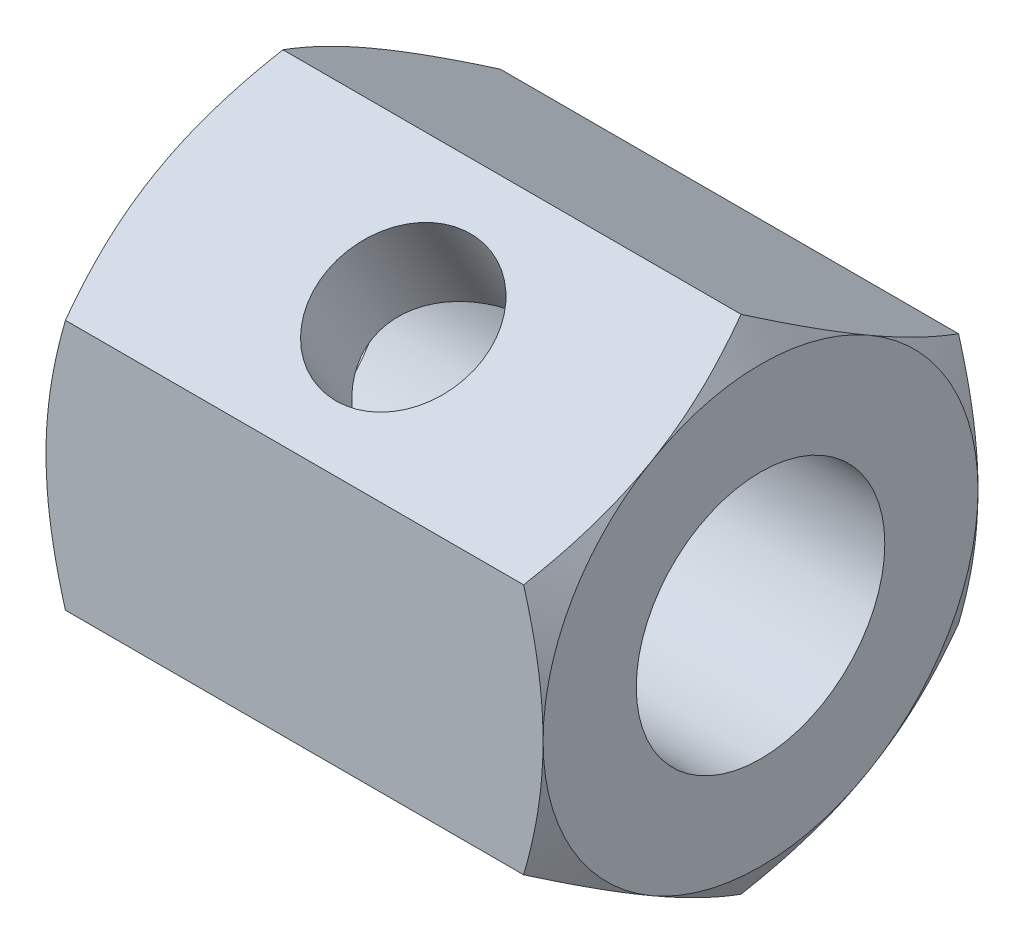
SolidWorks part; units mm, degrees
ref_plane "正面" through (0, 0, 0) normal (0, 0, 1) x (1, 0, 0)
ref_plane "平面" through (0, 0, 0) normal (0, 1, 0) x (1, 0, 0)
ref_plane "右側面" through (0, 0, 0) normal (1, 0, 0) x (0, 0, -1)
sketch "ｽｹｯﾁ1" plane through (0, 0, 0) normal (1, 0, 0) x (0, 0, -1)
  line L1 (0, 4.0415) -> (-3.5, 2.0207)
  line L2 (-3.5, 2.0207) -> (-3.5, -2.0207)
  line L3 (-3.5, -2.0207) -> (0, -4.0415)
  line L4 (0, -4.0415) -> (3.5, -2.0207)
  line L5 (3.5, -2.0207) -> (3.5, 2.0207)
  line L6 (3.5, 2.0207) -> (0, 4.0415)
  circle A0 centre (0, 0) radius 3.5 construction
  circle A1 centre (0, 0) radius 2
  dimension "D1" = 4
  dimension "D2" = 7
extrude "押し出し1" add sketch "ｽｹｯﾁ1" along normal mid plane 8
sketch "ｽｹｯﾁ3" plane through (0, 0, 0) normal (0, 1, 0) x (1, 0, 0)
  line L0 (4, -3.5) -> (1.1132, -8.5)
  line L1 (1.1132, -8.5) -> (4, -8.5)
  line L2 (4, -8.5) -> (4, -3.5)
  line L3 (-5.6565, 0) -> (5.9587, 0) construction
  dimension "D1" = 30
  dimension "D2" = 5
revolve "ｶｯﾄ - 回転1" cut sketch "ｽｹｯﾁ3" angle 360 about L3
mirror "ﾐﾗｰ1" about plane through (0, 0, 0) normal (1, 0, 0) of "ｶｯﾄ - 回転1"
hole_wizard "M3x0.5 ねじ穴1" positions "ｽｹｯﾁ5" profile "ｽｹｯﾁ4" tap size "M3x0.5" standard "JIS"
sketch "ｽｹｯﾁ5" plane through (0, 3.0311, 1.75) normal (0, 0.866, 0.5) x (-1, 0, 0)
  point P0 (0, 0)
sketch "ｽｹｯﾁ4" plane through (0, 3.0311, 1.75) normal (1, 0, 0) x (0, -0.5, 0.866)
  line L0 (0, 0) -> (0, 1.5)
  line L1 (0, 1.5) -> (1.25, 1.5)
  line L2 (1.25, 1.5) -> (1.25, 0)
  line L5 (1.25, 0) -> (0, 0)
  line L11 (0, -6.35) -> (0, 107.95) construction
  dimension "次ｻｰﾌｪｽまでのねじ下穴ﾄﾞﾘﾙの直径" = 2.5
  dimension "次ｻｰﾌｪｽまでのねじ下穴ﾄﾞﾘﾙの深さ" = 1.5
